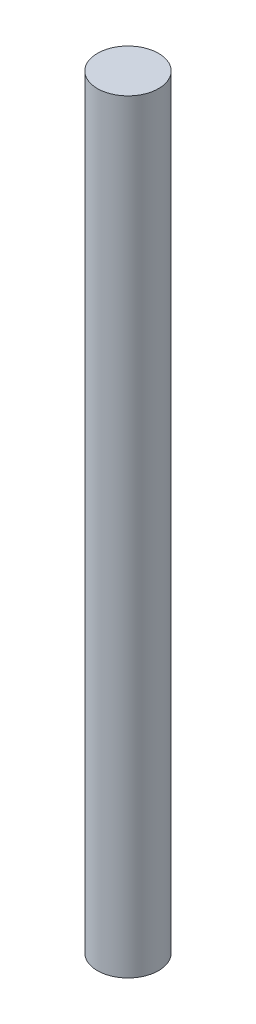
SolidWorks part; units mm, degrees
ref_plane "Front" through (0, 0, 0) normal (0, 0, 1) x (1, 0, 0)
ref_plane "Top" through (0, 0, 0) normal (0, 1, 0) x (1, 0, 0)
ref_plane "Right" through (0, 0, 0) normal (1, 0, 0) x (0, 0, -1)
sketch "Sketch1" plane through (0, 0, 0) normal (0, 1, 0) x (1, 0, 0)
  circle A0 centre (0, 0) radius 8
  dimension "D1" = 16
extrude "Extrude längd" add sketch "Sketch1" against normal blind 200
